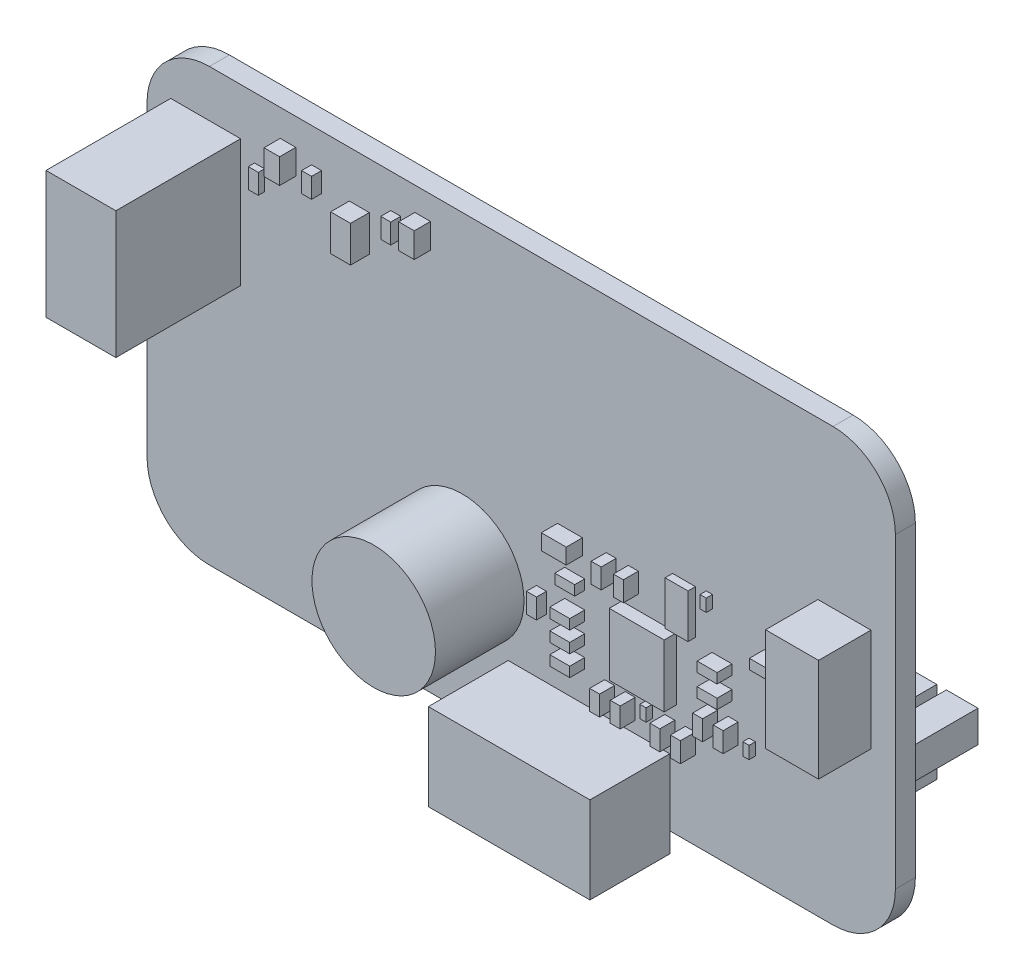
SolidWorks part; units mm, degrees
ref_plane "前视基准面" through (0, 0, 0) normal (0, 0, 1) x (1, 0, 0)
ref_plane "上视基准面" through (0, 0, 0) normal (0, 1, 0) x (1, 0, 0)
ref_plane "右视基准面" through (0, 0, 0) normal (1, 0, 0) x (0, 0, -1)
other "Configuration Table"
sketch "草图1" plane through (0, 0, 0) normal (0, 0, 1) x (1, 0, 0)
  line L0 (5, -34.619) -> (55, -34.619)
  line L1 (60, -29.619) -> (60, -5)
  line L2 (55, 0) -> (5, 0)
  line L3 (0, -5) -> (0, -29.619)
  arc A0 (55, -34.619) -> (60, -29.619) centre (55, -29.619) ccw
  arc A1 (60, -5) -> (55, 0) centre (55, -5) ccw
  arc A2 (5, 0) -> (0, -5) centre (5, -5) ccw
  arc A3 (0, -29.619) -> (5, -34.619) centre (5, -29.619) ccw
  dimension "D1" = 5
  dimension "D2" = 60
  dimension "D3" = 34.619
extrude "Source_PCB_outline_and_holes" add sketch "草图1" along normal blind 1.6 from offset 1.6 separate body
sketch "草图2" plane through (0, 0, 0) normal (0, 0, 1) x (1, 0, 0)
  circle A0 centre (25.273, -24.491) radius 4.95
  dimension "D1" = 9.9
  dimension "D2" = 25.273
  dimension "D3" = 24.491
extrude "Acoustic_cases_0" add sketch "草图2" along normal blind 7.1 separate body
sketch "草图3" plane through (0, 0, 0) normal (0, 0, 1) x (1, 0, 0)
  line L0 (10.678, -4.155) -> (11.928, -4.155)
  line L1 (11.928, -4.155) -> (11.928, -2.155)
  line L2 (11.928, -2.155) -> (10.678, -2.155)
  line L3 (10.678, -2.155) -> (10.678, -4.155)
  line L4 (21.473, -3.901) -> (22.723, -3.901)
  line L5 (22.723, -3.901) -> (22.723, -1.901)
  line L6 (22.723, -1.901) -> (21.473, -1.901)
  line L7 (21.473, -1.901) -> (21.473, -3.901)
  line L8 (32.909, -19.02) -> (34.909, -19.02)
  line L9 (34.909, -19.02) -> (34.909, -17.77)
  line L10 (34.909, -17.77) -> (32.909, -17.77)
  line L11 (32.909, -17.77) -> (32.909, -19.02)
  dimension "D1" = 10.678
  dimension "D2" = 11.928
  dimension "D3" = 21.473
  dimension "D4" = 32.909
  dimension "D5" = 34.909
  dimension "D6" = 1.901
  dimension "D7" = 2.155
  dimension "D8" = 17.77
extrude "Component_envelopes_1_1" add sketch "草图3" along normal blind 1.3 separate body
sketch "草图4" plane through (0, 0, 0) normal (0, 0, 1) x (1, 0, 0)
  line L0 (13.189, -4.336) -> (13.989, -4.336)
  line L1 (13.989, -4.336) -> (13.989, -2.736)
  line L2 (13.989, -2.736) -> (13.189, -2.736)
  line L3 (13.189, -2.736) -> (13.189, -4.336)
  line L4 (19.539, -4.336) -> (20.339, -4.336)
  line L5 (20.339, -4.336) -> (20.339, -2.736)
  line L6 (20.339, -2.736) -> (19.539, -2.736)
  line L7 (19.539, -2.736) -> (19.539, -4.336)
  line L8 (33.49, -21.335) -> (35.09, -21.335)
  line L9 (35.09, -21.335) -> (35.09, -20.535)
  line L10 (35.09, -20.535) -> (33.49, -20.535)
  line L11 (33.49, -20.535) -> (33.49, -21.335)
  line L12 (31.223, -24.529) -> (32.023, -24.529)
  line L13 (32.023, -24.529) -> (32.023, -22.929)
  line L14 (32.023, -22.929) -> (31.223, -22.929)
  line L15 (31.223, -22.929) -> (31.223, -24.529)
  dimension "D1" = 13.189
  dimension "D2" = 13.989
  dimension "D3" = 19.539
  dimension "D4" = 31.223
  dimension "D5" = 33.49
  dimension "D6" = 35.09
  dimension "D7" = 2.736
  dimension "D8" = 20.535
  dimension "D9" = 22.929
extrude "Component_envelopes_2_1" add sketch "草图4" along normal blind 0.8 separate body
sketch "草图5" plane through (0, 0, 0) normal (0, 0, 1) x (1, 0, 0)
  line L0 (39.986, -23.132) -> (40.786, -23.132)
  line L1 (40.786, -23.132) -> (40.786, -21.532)
  line L2 (40.786, -21.532) -> (39.986, -21.532)
  line L3 (39.986, -21.532) -> (39.986, -23.132)
  dimension "D1" = 39.986
  dimension "D2" = 40.786
  dimension "D3" = 21.532
  dimension "D4" = 23.132
extrude "Component_envelopes_3_1" add sketch "草图5" along normal blind 0.8 from offset 2.4 separate body
sketch "草图6" plane through (0, 0, 0) normal (0, 0, 1) x (1, 0, 0)
  line L0 (41.92, -23.078) -> (43.17, -23.078)
  line L1 (43.17, -23.078) -> (43.17, -21.078)
  line L2 (43.17, -21.078) -> (41.92, -21.078)
  line L3 (41.92, -21.078) -> (41.92, -23.078)
  dimension "D1" = 41.92
  dimension "D2" = 43.17
  dimension "D3" = 21.078
  dimension "D4" = 23.078
extrude "Component_envelopes_4_1" add sketch "草图6" along normal blind 1.3 from offset 2.9 separate body
sketch "草图7" plane through (0, 0, 0) normal (0, 0, 1) x (1, 0, 0)
  line L0 (40.009, -27.531) -> (40.509, -27.531)
  line L1 (40.509, -27.531) -> (40.509, -26.531)
  line L2 (40.509, -26.531) -> (40.009, -26.531)
  line L3 (40.009, -26.531) -> (40.009, -27.531)
  line L4 (48.264, -26.007) -> (48.764, -26.007)
  line L5 (48.764, -26.007) -> (48.764, -25.007)
  line L6 (48.764, -25.007) -> (48.264, -25.007)
  line L7 (48.264, -25.007) -> (48.264, -26.007)
  line L8 (44.835, -17.498) -> (45.335, -17.498)
  line L9 (45.335, -17.498) -> (45.335, -16.498)
  line L10 (45.335, -16.498) -> (44.835, -16.498)
  line L11 (44.835, -16.498) -> (44.835, -17.498)
  line L12 (8.6169, -6.495) -> (9.4169, -6.495)
  line L13 (9.4169, -6.495) -> (9.4169, -4.895)
  line L14 (9.4169, -4.895) -> (8.6169, -4.895)
  line L15 (8.6169, -4.895) -> (8.6169, -6.495)
  dimension "D1" = 8.6169
  dimension "D2" = 9.4169
  dimension "D3" = 40.009
  dimension "D4" = 40.509
  dimension "D5" = 44.835
  dimension "D6" = 48.264
  dimension "D7" = 4.895
  dimension "D8" = 6.495
  dimension "D9" = 16.498
  dimension "D10" = 17.498
  dimension "D11" = 25.007
  dimension "D12" = 26.531
extrude "Component_envelopes_5_1" add sketch "草图7" along normal blind 0.5 separate body
sketch "草图8" plane through (0, 0, 0) normal (0, 0, 1) x (1, 0, 0)
  line L0 (1.899, -13.97) -> (7.499, -13.97)
  line L1 (7.499, -13.97) -> (7.499, -3.77)
  line L2 (7.499, -3.77) -> (1.899, -3.77)
  line L3 (1.899, -3.77) -> (1.899, -13.97)
  dimension "D1" = 1.899
  dimension "D2" = 7.499
  dimension "D3" = 3.77
  dimension "D4" = 13.97
extrude "Component_envelopes_6_1" add sketch "草图8" along normal blind 10 separate body
sketch "草图9" plane through (0, 0, 0) normal (0, 0, 1) x (1, 0, 0)
  line L0 (36.811, -19.449) -> (37.611, -19.449)
  line L1 (37.611, -19.449) -> (37.611, -17.849)
  line L2 (37.611, -17.849) -> (36.811, -17.849)
  line L3 (36.811, -17.849) -> (36.811, -19.449)
  line L4 (38.589, -19.449) -> (39.389, -19.449)
  line L5 (39.389, -19.449) -> (39.389, -17.849)
  line L6 (39.389, -17.849) -> (38.589, -17.849)
  line L7 (38.589, -17.849) -> (38.589, -19.449)
  line L8 (33.49, -25.145) -> (35.09, -25.145)
  line L9 (35.09, -25.145) -> (35.09, -24.345)
  line L10 (35.09, -24.345) -> (33.49, -24.345)
  line L11 (33.49, -24.345) -> (33.49, -25.145)
  line L12 (33.49, -26.796) -> (35.09, -26.796)
  line L13 (35.09, -26.796) -> (35.09, -25.996)
  line L14 (35.09, -25.996) -> (33.49, -25.996)
  line L15 (33.49, -25.996) -> (33.49, -26.796)
  line L16 (38.335, -28.339) -> (39.135, -28.339)
  line L17 (39.135, -28.339) -> (39.135, -26.739)
  line L18 (39.135, -26.739) -> (38.335, -26.739)
  line L19 (38.335, -26.739) -> (38.335, -28.339)
  line L20 (36.684, -28.339) -> (37.484, -28.339)
  line L21 (37.484, -28.339) -> (37.484, -26.739)
  line L22 (37.484, -26.739) -> (36.684, -26.739)
  line L23 (36.684, -26.739) -> (36.684, -28.339)
  line L24 (43.161, -28.339) -> (43.961, -28.339)
  line L25 (43.961, -28.339) -> (43.961, -26.739)
  line L26 (43.961, -26.739) -> (43.161, -26.739)
  line L27 (43.161, -26.739) -> (43.161, -28.339)
  line L28 (41.51, -28.339) -> (42.31, -28.339)
  line L29 (42.31, -28.339) -> (42.31, -26.739)
  line L30 (42.31, -26.739) -> (41.51, -26.739)
  line L31 (41.51, -26.739) -> (41.51, -28.339)
  dimension "D1" = 33.49
  dimension "D2" = 35.09
  dimension "D3" = 36.684
  dimension "D4" = 36.811
  dimension "D5" = 37.484
  dimension "D6" = 38.335
  dimension "D7" = 38.589
  dimension "D8" = 41.51
  dimension "D9" = 43.161
  dimension "D10" = 17.849
  dimension "D11" = 24.345
  dimension "D12" = 25.996
  dimension "D13" = 26.739
extrude "Component_envelopes_7_1" add sketch "草图9" along normal blind 1.2 separate body
sketch "草图10" plane through (0, 0, 0) normal (0, 0, 1) x (1, 0, 0)
  line L0 (46.59, -25.926) -> (47.39, -25.926)
  line L1 (47.39, -25.926) -> (47.39, -24.326)
  line L2 (47.39, -24.326) -> (46.59, -24.326)
  line L3 (46.59, -24.326) -> (46.59, -25.926)
  line L4 (44.939, -25.926) -> (45.739, -25.926)
  line L5 (45.739, -25.926) -> (45.739, -24.326)
  line L6 (45.739, -24.326) -> (44.939, -24.326)
  line L7 (44.939, -24.326) -> (44.939, -25.926)
  line L8 (45.301, -21.335) -> (46.901, -21.335)
  line L9 (46.901, -21.335) -> (46.901, -20.535)
  line L10 (46.901, -20.535) -> (45.301, -20.535)
  line L11 (45.301, -20.535) -> (45.301, -21.335)
  line L12 (49.492, -19.049) -> (51.092, -19.049)
  line L13 (51.092, -19.049) -> (51.092, -18.249)
  line L14 (51.092, -18.249) -> (49.492, -18.249)
  line L15 (49.492, -18.249) -> (49.492, -19.049)
  line L16 (33.49, -23.494) -> (35.09, -23.494)
  line L17 (35.09, -23.494) -> (35.09, -22.694)
  line L18 (35.09, -22.694) -> (33.49, -22.694)
  line L19 (33.49, -22.694) -> (33.49, -23.494)
  line L20 (45.301, -23.113) -> (46.901, -23.113)
  line L21 (46.901, -23.113) -> (46.901, -22.313)
  line L22 (46.901, -22.313) -> (45.301, -22.313)
  line L23 (45.301, -22.313) -> (45.301, -23.113)
  dimension "D1" = 33.49
  dimension "D2" = 35.09
  dimension "D3" = 44.939
  dimension "D4" = 45.301
  dimension "D5" = 45.739
  dimension "D6" = 46.59
  dimension "D7" = 49.492
  dimension "D8" = 18.249
  dimension "D9" = 20.535
  dimension "D10" = 22.313
  dimension "D11" = 22.694
  dimension "D12" = 24.326
extrude "Component_envelopes_7_2" add sketch "草图10" along normal blind 1.2 separate body
sketch "草图11" plane through (0, 0, 0) normal (0, 0, 1) x (1, 0, 0)
  line L0 (42.1359, -20.1561) -> (43.9701, -20.1561)
  line L1 (43.9701, -20.1561) -> (43.9701, -16.6339)
  line L2 (43.9701, -16.6339) -> (42.1359, -16.6339)
  line L3 (42.1359, -16.6339) -> (42.1359, -20.1561)
  dimension "D1" = 42.1359
  dimension "D2" = 43.9701
  dimension "D3" = 16.6339
  dimension "D4" = 20.1561
extrude "Component_envelopes_8_1" add sketch "草图11" along normal blind 0.6 separate body
sketch "草图12" plane through (0, 0, 0) normal (0, 0, 1) x (1, 0, 0)
  line L0 (28.956, -36.223) -> (41.91, -36.223)
  line L1 (41.91, -36.223) -> (41.91, -29.269)
  line L2 (41.91, -29.269) -> (28.956, -29.269)
  line L3 (28.956, -29.269) -> (28.956, -36.223)
  dimension "D1" = 28.956
  dimension "D2" = 41.91
  dimension "D3" = 29.269
  dimension "D4" = 36.223
extrude "Component_envelopes_9_1" add sketch "草图12" along normal blind 6.4 separate body
sketch "草图13" plane through (0, 0, 0) normal (0, 0, 1) x (1, 0, 0)
  line L0 (16.218, -6.637) -> (17.818, -6.637)
  line L1 (17.818, -6.637) -> (17.818, -3.737)
  line L2 (17.818, -3.737) -> (16.218, -3.737)
  line L3 (16.218, -3.737) -> (16.218, -6.637)
  dimension "D1" = 16.218
  dimension "D2" = 17.818
  dimension "D3" = 3.737
  dimension "D4" = 6.637
extrude "Component_envelopes_10_1" add sketch "草图13" along normal blind 1.5 separate body
sketch "草图14" plane through (0, 0, 0) normal (0, 0, 1) x (1, 0, 0)
  line L0 (38.059, -25.594) -> (42.459, -25.594)
  line L1 (42.459, -25.594) -> (42.459, -20.594)
  line L2 (42.459, -20.594) -> (38.059, -20.594)
  line L3 (38.059, -20.594) -> (38.059, -25.594)
  dimension "D1" = 38.059
  dimension "D2" = 42.459
  dimension "D3" = 20.594
  dimension "D4" = 25.594
extrude "Component_envelopes_11_1" add sketch "草图14" along normal blind 1 separate body
sketch "草图15" plane through (0, 0, 0) normal (0, 0, 1) x (1, 0, 0)
  line L0 (53.789, -20.869) -> (58.039, -20.869)
  line L1 (58.039, -20.869) -> (58.039, -12.619)
  line L2 (58.039, -12.619) -> (53.789, -12.619)
  line L3 (53.789, -12.619) -> (53.789, -20.869)
  dimension "D1" = 53.789
  dimension "D2" = 58.039
  dimension "D3" = 12.619
  dimension "D4" = 20.869
extrude "Component_envelopes_12_1" add sketch "草图15" along normal blind 4.2 separate body
sketch "草图16" plane through (0, 0, 0) normal (0, 0, 1) x (1, 0, 0)
  line L0 (54.483, -25.888) -> (57.023, -25.888)
  line L1 (57.023, -25.888) -> (57.023, -23.348)
  line L2 (57.023, -23.348) -> (54.483, -23.348)
  line L3 (54.483, -23.348) -> (54.483, -25.888)
  line L4 (39.624, -15.474) -> (42.164, -15.474)
  line L5 (42.164, -15.474) -> (42.164, -12.934)
  line L6 (42.164, -12.934) -> (39.624, -12.934)
  line L7 (39.624, -12.934) -> (39.624, -15.474)
  line L8 (51.181, -25.888) -> (53.721, -25.888)
  line L9 (53.721, -25.888) -> (53.721, -23.348)
  line L10 (53.721, -23.348) -> (51.181, -23.348)
  line L11 (51.181, -23.348) -> (51.181, -25.888)
  line L12 (48.26, -15.474) -> (50.8, -15.474)
  line L13 (50.8, -15.474) -> (50.8, -12.934)
  line L14 (50.8, -12.934) -> (48.26, -12.934)
  line L15 (48.26, -12.934) -> (48.26, -15.474)
  line L16 (51.181, -29.952) -> (53.721, -29.952)
  line L17 (53.721, -29.952) -> (53.721, -27.412)
  line L18 (53.721, -27.412) -> (51.181, -27.412)
  line L19 (51.181, -27.412) -> (51.181, -29.952)
  dimension "D1" = 39.624
  dimension "D2" = 42.164
  dimension "D3" = 48.26
  dimension "D4" = 51.181
  dimension "D5" = 54.483
  dimension "D6" = 12.934
  dimension "D7" = 23.348
  dimension "D8" = 27.412
extrude "Component_envelopes_13_1" add sketch "草图16" along normal blind 8 from offset 9.6 separate body
